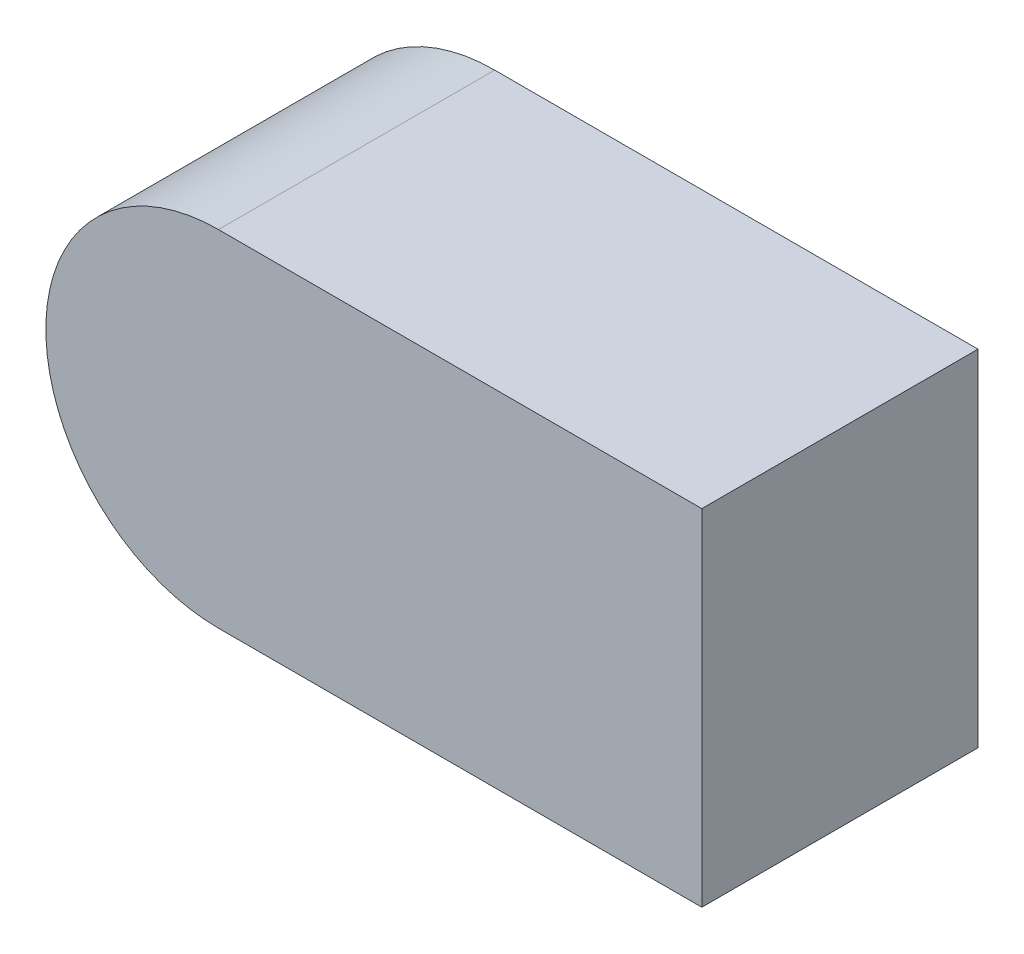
SolidWorks part; units mm, degrees
ref_plane "Plan1" through (0, 0, 0) normal (0, 0, 1) x (1, 0, 0)
ref_plane "Plan2" through (0, 0, 0) normal (0, 1, 0) x (1, 0, 0)
ref_plane "Plan3" through (0, 0, 0) normal (1, 0, 0) x (0, 0, -1)
sketch "Esquisse1" plane through (0, 0, 0) normal (0, 0, 1) x (1, 0, 0)
  line L0 (-7, 5) -> (7, 5)
  line L1 (0, 0) -> (0, 6.9194) construction
  line L2 (-7, -5) -> (7, -5)
  line L3 (7, 5) -> (7, -5)
  arc A0 (-7, 5) -> (-7, -5) centre (-7, 0) ccw
  dimension "D1" = 10
  dimension "D2" = 5
  dimension "D4" = 7
extrude "Base-Extrusion" add sketch "Esquisse1" against normal blind 8
